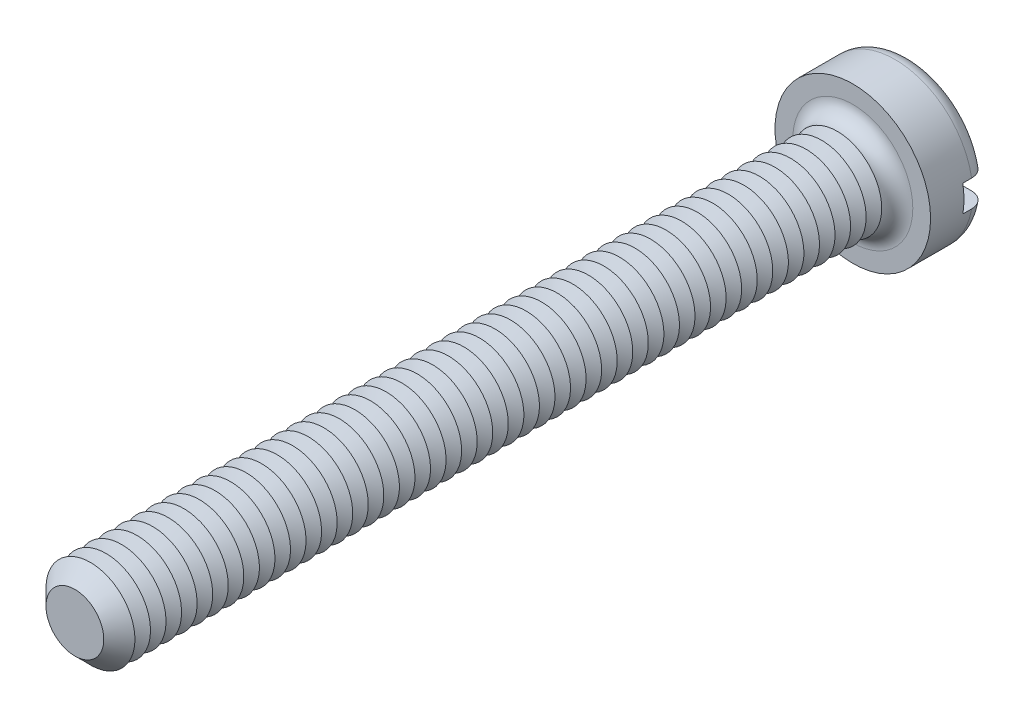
SolidWorks part; units mm, degrees
ref_plane "Front Plane" through (0, 0, 0) normal (0, 0, 1) x (1, 0, 0)
ref_plane "Top Plane" through (0, 0, 0) normal (0, 1, 0) x (1, 0, 0)
ref_plane "Right Plane" through (0, 0, 0) normal (1, 0, 0) x (0, 0, -1)
sketch "Sketch3" plane through (0, 0, 0) normal (0, 0, 1) x (1, 0, 0)
  circle A0 centre (0, 0) radius 3.5
  dimension "D1" = 7
extrude "Boss-Extrude2" add sketch "Sketch3" against normal blind 2.6
sketch "Sketch4" plane through (0, 0, 0) normal (0, 0, 1) x (1, 0, 0)
  circle A0 centre (0, 0) radius 2
  dimension "D1" = 4
extrude "Boss-Extrude3" add sketch "Sketch4" along normal blind 35
fillet "Fillet1" radius 0.7 2 edges at (3.5, 0, -2.6) (2, 0, 0)
chamfer "Chamfer1" distance 0.7 angle 45 1 edges at (2, 0, 35)
sketch "Sketch5" plane through (0, 0, 0) normal (1, 0, 0) x (0, 0, -1)
  line L0 (1.6944, 0) -> (-7.6738, 0) construction
sketch "Sketch6" plane through (0, 0, 0) normal (1, 0, 0) x (0, 0, -1)
  line L0 (-0.7, 2) -> (-1.05, 1.3938)
  line L1 (-1.05, 1.3938) -> (-1.4, 2)
  line L2 (-0.7, 2) -> (-34.3, 2) construction
  line L3 (-1.4, 2) -> (-0.7, 2)
  dimension "D1" = 0.7
revolve "Cut-Revolve1" cut sketch "Sketch6" angle 360 about L0
pattern_linear "LPattern1" count 48 spacing 0.7 along (0, 0, 1) of "Cut-Revolve1"
sketch "Sketch8" plane through (0, 0, -2.6) normal (0, 0, -1) x (-1, 0, 0)
  line L1 (3.5, -0.6) -> (-3.5, -0.6)
  line L2 (3.5, -0.6) -> (3.5, 0.6)
  line L3 (3.5, 0.6) -> (-3.5, 0.6)
  line L4 (-3.5, -0.6) -> (-3.5, 0.6)
  line L5 (3.5, -0.6) -> (-3.5, 0.6) construction
  line L6 (3.5, 0.6) -> (-3.5, -0.6) construction
  point P0 (0, 0)
  dimension "D1" = 7
  dimension "D2" = 1.2
extrude "Cut-Extrude1" cut sketch "Sketch8" against normal blind 1.1
